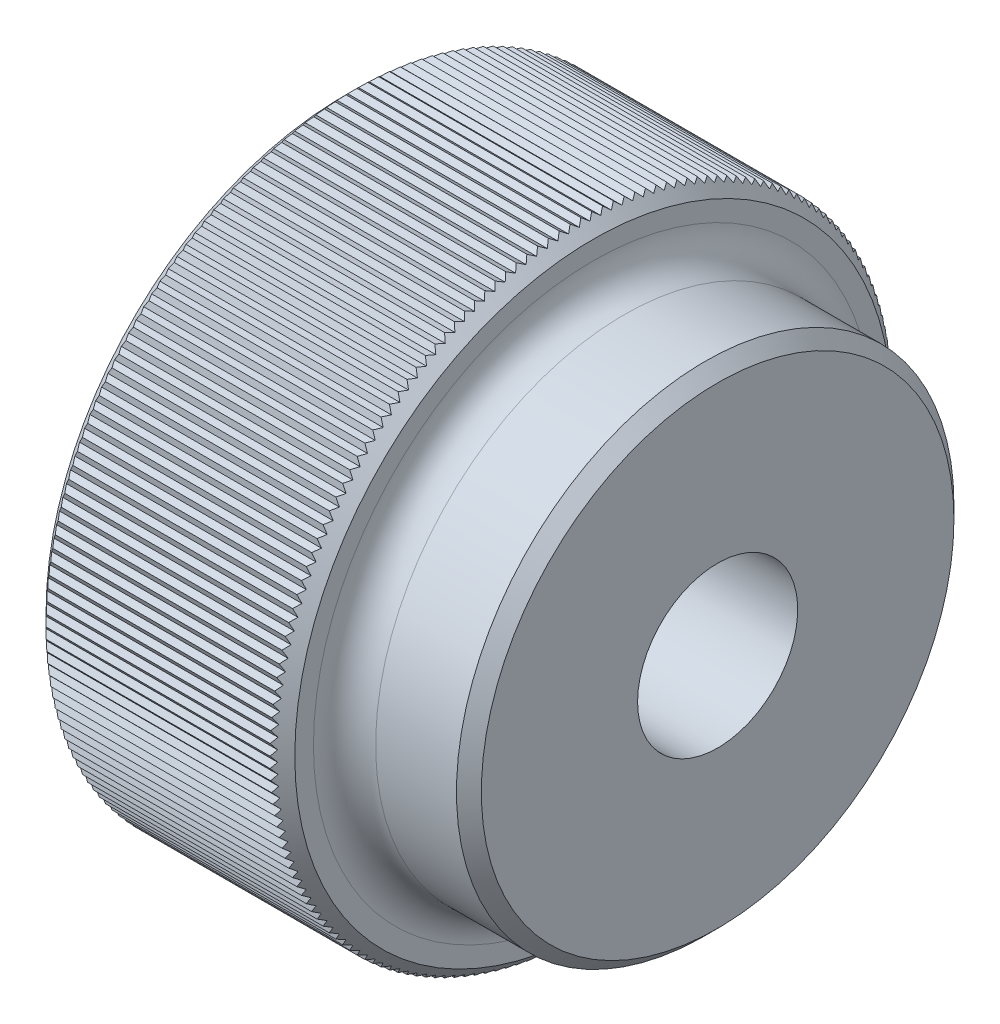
SolidWorks part; units mm, degrees
ref_plane "Front Plane" through (0, 0, 0) normal (0, 0, 1) x (1, 0, 0)
ref_plane "Top Plane" through (0, 0, 0) normal (0, 1, 0) x (1, 0, 0)
ref_plane "Right Plane" through (0, 0, 0) normal (1, 0, 0) x (0, 0, -1)
sketch "Sketch1" plane through (0, 0, 0) normal (1, 0, 0) x (0, 0, -1)
  circle A0 centre (0, 0) radius 20
  dimension "D1" = 40
extrude "Extrude1" add sketch "Sketch1" against normal blind 16
chamfer "Chamfer1" distance 0.8 angle 45 2 edges at (-16, 0, -20) (0, 0, -20)
sketch "Sketch2" plane through (0, 0, 0) normal (1, 0, 0) x (0, 0, -1)
  line L0 (0, 0) -> (0, 50000) construction
  line L1 (0, 0) -> (-872.6203, 49992.3848) construction
  line L2 (0, 20) -> (-0.3447, 19.75)
  line L3 (-0.698, 19.9878) -> (-0.3447, 19.75)
  circle A0 centre (0, 0) radius 20 construction
  arc A1 (-0.698, 19.9878) -> (0, 20) centre (-0.3577, 20.4933) cw
  dimension "D1" = 1
  dimension "D2" = 0.25
extrude "Extrude2" cut sketch "Sketch2" against normal through all
pattern_circular "CirPattern1" count 180 over 360 about axis through (0, 0, 0) along (1, 0, 0) of "Extrude2"
sketch "Sketch3" plane through (0, 0, 0) normal (1, 0, 0) x (0, 0, -1)
  circle A0 centre (0, 0) radius 16
  dimension "D1" = 32
extrude "Extrude3" add sketch "Sketch3" along normal blind 8
fillet "Fillet1" radius 2 1 edges at (0, 0, -16)
sketch "Sketch4" plane through (-16, 0, 0) normal (-1, 0, 0) x (0, 0, 1)
  circle A0 centre (0, 0) radius 5.15
  dimension "D1" = 10.3
extrude "Extrude4" cut sketch "Sketch4" against normal through all
sketch "Sketch5" plane through (-16, 0, 0) normal (-1, 0, 0) x (0, 0, 1)
  circle A0 centre (0, 0) radius 17
  dimension "D1" = 34
extrude "Extrude5" cut sketch "Sketch5" against normal blind 10
chamfer "Chamfer2" distance 0.8 angle 45 3 edges at (-16, 0, 17) (8, 0, -16) (-6, 0, 5.15)
sketch "Sketch6" plane through (0, 0, 0) normal (0, 0, 1) x (1, 0, 0)
  line L0 (8, -15.2) -> (8, 15.2) construction
  circle A0 centre (4, 0) radius 1.95
  dimension "D1" = 3.9
  dimension "D2" = 4
extrude "Extrude6" [suppressed] cut sketch "Sketch6" along normal through all
